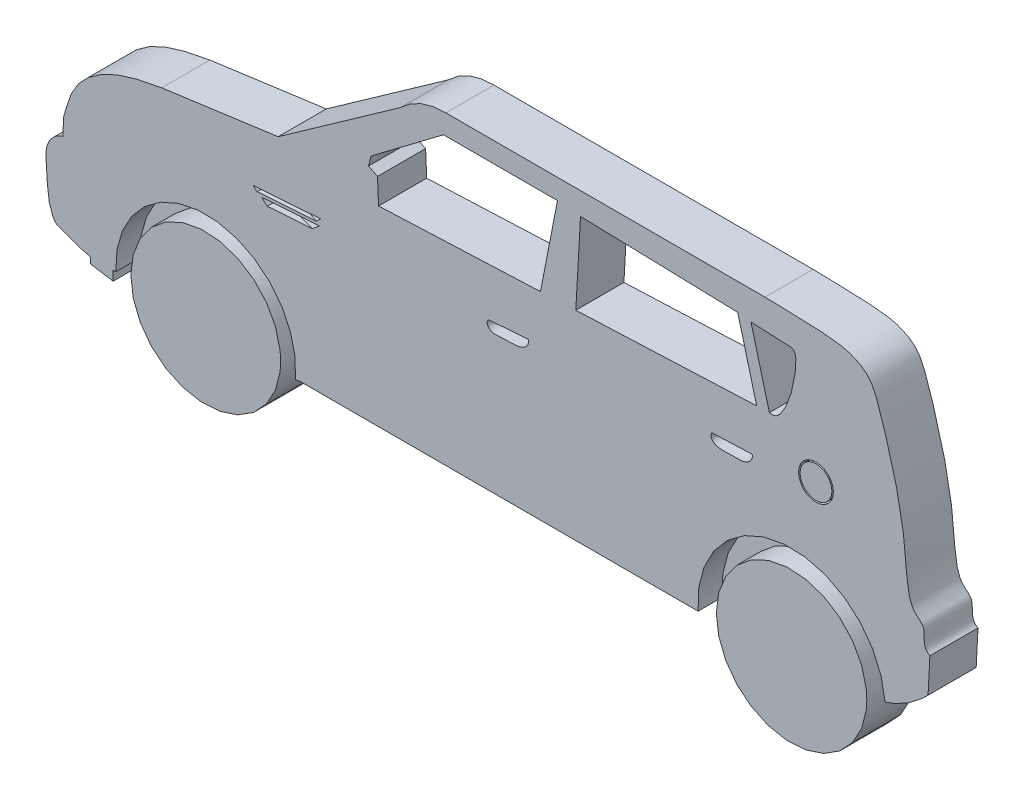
SolidWorks part; units mm, degrees
ref_plane "Front Plane" through (0, 0, 0) normal (0, 0, 1) x (1, 0, 0)
ref_plane "Top Plane" through (0, 0, 0) normal (0, 1, 0) x (1, 0, 0)
ref_plane "Right Plane" through (0, 0, 0) normal (1, 0, 0) x (0, 0, -1)
sketch "Sketch1" plane through (0, 0, 0) normal (0, 0, 1) x (1, 0, 0)
  line L0 (23.1964, 28.1968) -> (40.0395, 28.1968)
  line L1 (15.8977, 12.0755) -> (36.5105, 12.0755)
  line L2 (8.2022, 21.8447) -> (12.7296, 22.4621)
  line L3 (12.7296, 22.4621) -> (14.3474, 22.6827)
  line L4 (14.3474, 22.6827) -> (20.7902, 27.2343)
  line L5 (6.6201, 11.8441) -> (6.234, 11.5926)
  line L6 (6.234, 11.5926) -> (5.8201, 12.2278)
  line L7 (5.8201, 12.2278) -> (5.6326, 12.2278)
  line L8 (5.6326, 12.2278) -> (5.6326, 11.7184)
  line L9 (5.6326, 11.7184) -> (4.4481, 11.9102)
  line L10 (4.4481, 11.9102) -> (4.4481, 12.2278)
  line L11 (36.5105, 12.0755) -> (37.5612, 11.644)
  line L12 (48.6474, 14.3022) -> (48.743, 16.1568)
  arc A0 (6.6201, 11.8441) -> (14.2699, 11.2085) centre (10.5239, 12.4765) ccw
  arc A1 (37.5612, 11.644) -> (45.407, 12.6994) centre (41.4431, 12.4765) ccw
  arc A2 (20.7902, 27.2343) -> (23.1964, 28.1968) centre (23.092, 24.9688) cw
  spline S0 degree 3 poles (15.8977, 12.0755) (15.6192, 12.1007) (14.9102, 12.061) (14.498, 11.4626) (14.2699, 11.2085) knots 0 0 0 0 0.444316 1 1 1 1
  spline S1 degree 3 poles (4.4481, 12.2278) (3.9309, 12.3349) (3.3651, 12.5918) (2.6049, 12.8095) (2.3462, 13.278) (2.1518, 14.0792) (2.1489, 15.1044) (2.0072, 16.2985) (2.5843, 16.9216) (2.9931, 17.0204) knots 0 0 0 0 0.235203 0.298015 0.339621 0.469394 0.672528 0.809197 1 1 1 1
  spline S2 degree 3 poles (45.407, 12.6994) (46.6532, 12.7271) (47.8042, 13.4256) (48.6474, 14.3022) knots 0 0 0 0 1 1 1 1
  spline S3 degree 3 poles (48.743, 16.1568) (48.4742, 16.291) (48.4197, 16.7048) (48.4766, 17.3689) (47.7963, 17.7495) (47.5235, 18.8269) (47.4102, 21.6899) (46.6517, 24.4409) (45.8416, 26.7779) (45.3762, 27.5554) (44.3639, 27.9866) (42.4964, 28.165) (41.2454, 28.1652) (40.0395, 28.1968) knots 0 0 0 0 0.042509 0.071698 0.10477 0.161037 0.25224 0.604807 0.640598 0.679235 0.757025 0.817385 1 1 1 1
  spline S4 degree 3 poles (2.9931, 17.0204) (3.0292, 17.2475) (2.9214, 17.7422) (3.1707, 18.41) (3.3653, 19.1127) (3.7547, 19.8382) (4.4857, 20.5762) (5.9576, 21.4249) (7.3004, 21.6897) (8.2022, 21.8447) knots 0 0 0 0 0.086881 0.183888 0.263027 0.363981 0.49117 0.651222 1 1 1 1
extrude "Boss-Extrude1" add sketch "Sketch1" along normal blind 2.54
sketch "Sketch2" plane through (0, 0, 2.54) normal (0, 0, 1) x (1, 0, 0)
  line L0 (15.6354, 19.9799) -> (13.0169, 19.802)
  line L1 (13.0169, 19.802) -> (13.2326, 19.6138)
  line L2 (13.2326, 19.6138) -> (15.4265, 19.7628)
  line L3 (15.4265, 19.7628) -> (15.6354, 19.9799)
  line L5 (15.4265, 19.6138) -> (13.4874, 19.4821)
  line L6 (13.4874, 19.4821) -> (13.765, 19.215)
  line L7 (13.765, 19.215) -> (15.0436, 19.3018)
  line L8 (15.0436, 19.3018) -> (15.4265, 19.6138)
  line L9 (25.4482, 19.8714) -> (27.5459, 20.0138)
  line L10 (37.2368, 20.595) -> (39.3611, 20.6774)
  line L12 (19.1135, 23.7252) -> (19.2479, 24.2501)
  line L13 (19.2479, 24.2501) -> (23.0692, 27.1323)
  line L14 (23.0692, 27.1323) -> (29.0872, 27.1323)
  line L15 (29.0872, 27.1323) -> (28.1915, 22.5255)
  line L16 (28.1915, 22.5255) -> (19.645, 22.1647)
  line L17 (19.645, 22.1647) -> (19.589, 23.4914)
  line L18 (19.589, 23.4914) -> (19.1135, 23.7252)
  line L19 (30.3034, 27.0185) -> (38.6003, 26.7804)
  line L20 (38.6003, 26.7804) -> (39.6027, 23.0072)
  line L21 (39.6027, 23.0072) -> (30.0543, 22.6041)
  line L22 (30.0543, 22.6041) -> (30.3034, 27.0185)
  line L24 (41.2548, 26.6019) -> (39.3015, 26.6857)
  line L25 (39.3015, 26.6857) -> (40.2713, 23.0354)
  line L26 (41.2548, 26.6019) -> (41.2841, 26.6019)
  circle A0 centre (42.7315, 21.0877) radius 0.9208
  circle A1 centre (42.7315, 21.0877) radius 0.8423
  circle A2 centre (41.4431, 12.4765) radius 3.9702
  circle A3 centre (10.5239, 12.4765) radius 3.9547
  circle A4 centre (41.4431, 12.4765) radius 4.9492
  circle A5 centre (10.5239, 12.4765) radius 4.7519
  spline S0 degree 3 poles (27.5459, 20.0138) (27.6078, 19.7499) (27.2767, 19.4395) (26.6509, 19.4029) (26.1345, 19.4034) (25.5573, 19.3273) (25.2741, 19.6787) (25.4482, 19.8714) knots 0 0 0 0 0.241726 0.405542 0.653556 0.79579 1 1 1 1
  spline S1 degree 3 poles (37.2368, 20.595) (37.0909, 20.2733) (37.6309, 20.0065) (38.3225, 20.1278) (39.0492, 20.0339) (39.4234, 20.4483) (39.3611, 20.6774) knots 0 0 0 0 0.26196 0.513034 0.771946 1 1 1 1
  spline S2 degree 3 poles (40.2713, 23.0354) (40.6173, 22.9364) (41.2813, 23.7739) (41.5655, 24.9766) (41.7096, 26.1031) (41.6203, 26.6255) (41.2841, 26.6019) knots 0 0 0 0 0.198856 0.677172 0.84264 1 1 1 1
extrude "Cut-Extrude2" cut sketch "Sketch2" against normal blind 1.27
chamfer "Chamfer1" distance 0.635 angle 30 2 edges at (15.235, 19.4578, 2.54) (15.5309, 19.8714, 2.54)
sketch "Sketch3" plane through (0, 0, 1.27) normal (0, 0, 1) x (1, 0, 0)
  line L0 (23.0692, 27.1323) -> (29.0872, 27.1323)
  line L1 (29.0872, 27.1323) -> (28.1915, 22.5255)
  line L2 (28.1915, 22.5255) -> (19.645, 22.1647)
  line L3 (19.645, 22.1647) -> (19.589, 23.4914)
  line L4 (19.589, 23.4914) -> (19.1135, 23.7252)
  line L5 (19.1135, 23.7252) -> (19.2479, 24.2501)
  line L6 (19.2479, 24.2501) -> (23.0692, 27.1323)
  line L7 (30.3034, 27.0185) -> (38.6003, 26.7804)
  line L8 (38.6003, 26.7804) -> (39.6027, 23.0072)
  line L9 (39.6027, 23.0072) -> (30.0543, 22.6041)
  line L10 (30.0543, 22.6041) -> (30.3034, 27.0185)
  line L11 (41.2548, 26.6019) -> (39.3015, 26.6857)
  line L12 (39.3015, 26.6857) -> (40.2713, 23.0354)
  line L13 (39.3015, 26.6857) -> (40.2713, 23.0354) construction
  spline S0 degree 3 poles (40.2713, 23.0354) (40.6173, 22.9364) (41.2813, 23.7739) (41.5655, 24.9766) (41.7096, 26.1031) (41.6203, 26.6255) (41.2841, 26.6019) knots 0 0 0 0 0.198856 0.677172 0.84264 1 1 1 1 construction
  spline S1 degree 3 poles (40.2713, 23.0354) (40.4494, 22.9655) (41.1225, 23.3028) (41.435, 24.5996) (41.7774, 25.7478) (41.5983, 26.668) (41.2548, 26.6019) knots 0 0 0 0 0.12085 0.466674 0.829672 1 1 1 1
  spline S2 degree 3 poles (40.2713, 23.0354) (40.6173, 22.9364) (41.2813, 23.7739) (41.5655, 24.9766) (41.7096, 26.1031) (41.6203, 26.6255) (41.2841, 26.6019) knots 0 0 0 0 0.198856 0.677172 0.84264 1 1 1 1 construction
extrude "Cut-Extrude3" cut sketch "Sketch3" against normal through all
